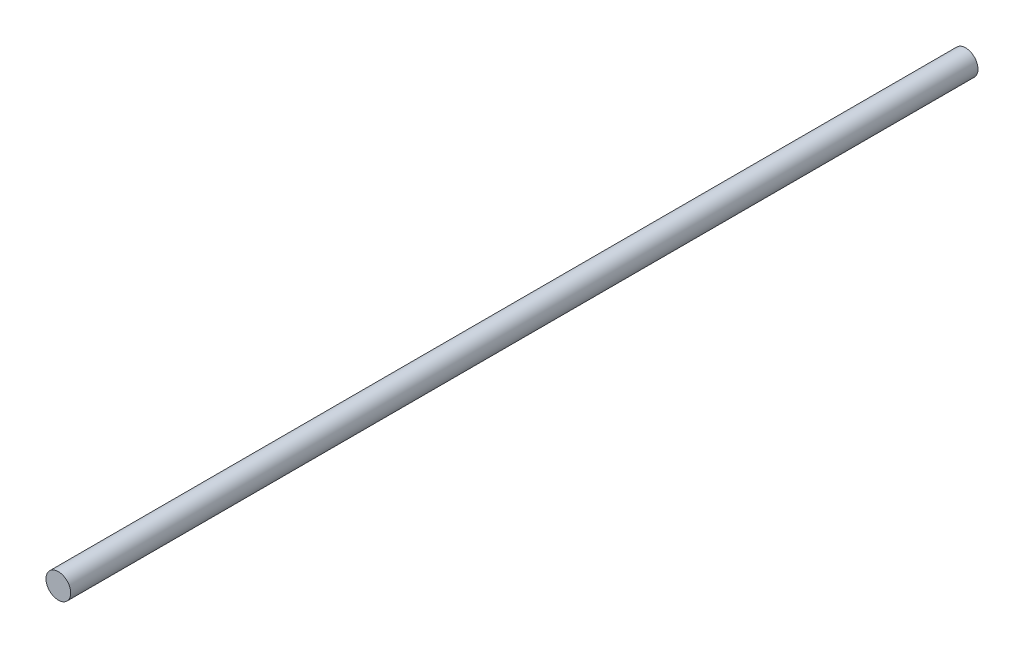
SolidWorks part; units mm, degrees
ref_plane "Front Plane" through (0, 0, 0) normal (0, 0, 1) x (1, 0, 0)
ref_plane "Top Plane" through (0, 0, 0) normal (0, 1, 0) x (1, 0, 0)
ref_plane "Right Plane" through (0, 0, 0) normal (1, 0, 0) x (0, 0, -1)
sketch "Sketch1" plane through (0, 0, 0) normal (0, 0, 1) x (1, 0, 0)
  circle A0 centre (0, 0) radius 30
  dimension "D1" = 60
extrude "Boss-Extrude1" add sketch "Sketch1" against normal blind 2200
